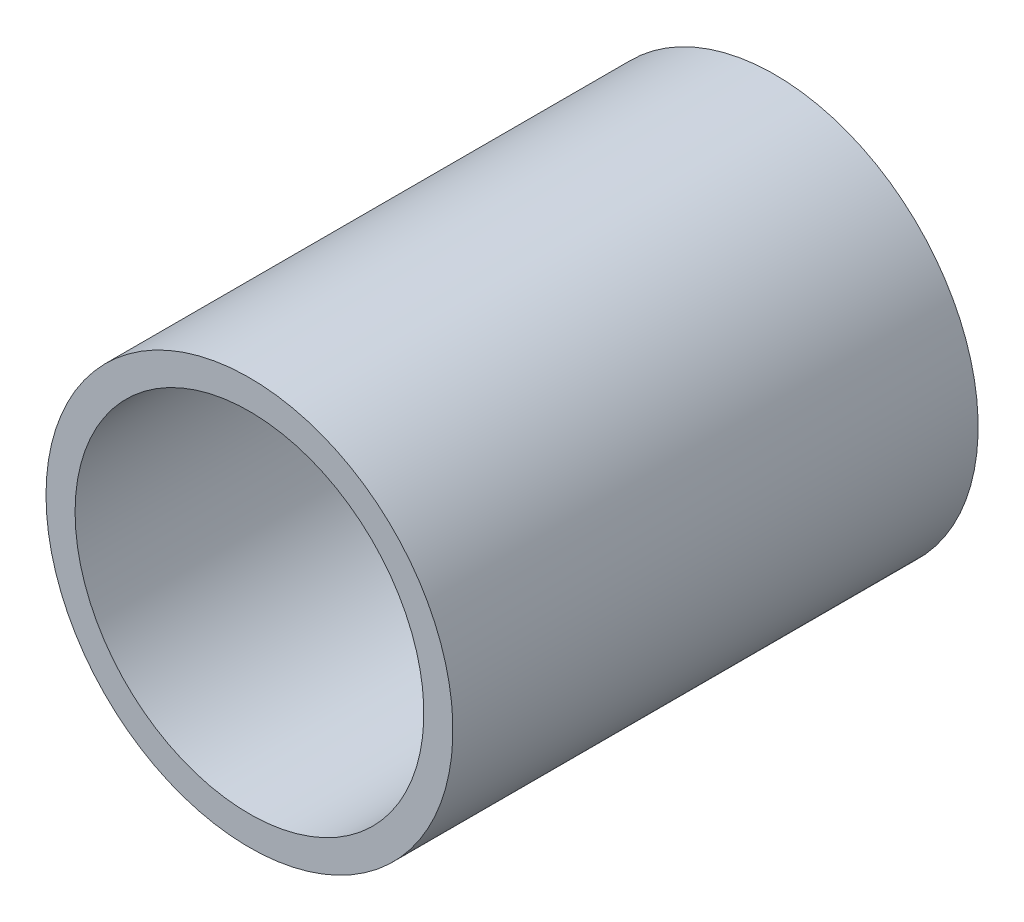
SolidWorks part; units mm, degrees
ref_plane "Front Plane" through (0, 0, 0) normal (0, 0, 1) x (1, 0, 0)
ref_plane "Top Plane" through (0, 0, 0) normal (0, 1, 0) x (1, 0, 0)
ref_plane "Right Plane" through (0, 0, 0) normal (1, 0, 0) x (0, 0, -1)
imported_body "Imported1"
ref_plane "Plane1" through (0, 0, -112.3547) normal (0, 0, 1) x (1, 0, 0)
sketch "Sketch3" plane through (0, 0, -112.3547) normal (0, 0, 1) x (1, 0, 0)
  circle A0 centre (0, 0) radius 17.5 construction
  circle A1 centre (0, 0) radius 17.5
extrude "Cut-Extrude2" cut sketch "Sketch3" against normal mid plane 0.0025
move or copy body "Body-Move/Copy3" bodies to move or copy 107 copy no translate (0, 0, 6350)
sketch "Sketch4" plane through (0, 0, -112.356) normal (0, 0, 1) x (1, 0, 0)
  circle A0 centre (0, 0) radius 15 construction
  circle A1 centre (0, 0) radius 17.5 construction
  circle A2 centre (0, 0) radius 15
  circle A3 centre (0, 0) radius 17.5
extrude "Boss-Extrude2" add sketch "Sketch4" along normal up to surface (6350.0025 mm away)
ref_plane "Plane3" through (0, 0, -189.5547) normal (0, 0, -1) x (-1, 0, 0)
sketch "Sketch7" plane through (0, 0, -189.5547) normal (0, 0, 1) x (1, 0, 0)
  circle A0 centre (0, 0) radius 17.5 construction
  circle A1 centre (0, 0) radius 17.5
extrude "Cut-Extrude3" cut sketch "Sketch7" along normal blind 6510.02
move or copy body "Body-Move/Copy4" bodies to move or copy 111 placed by mates yes
combine bodies "Combine1" operation type add bodies to combine 113 112
ref_plane "Plane4" through (0, 0, -192.3647) normal (0, 0, -1) x (-1, 0, 0)
